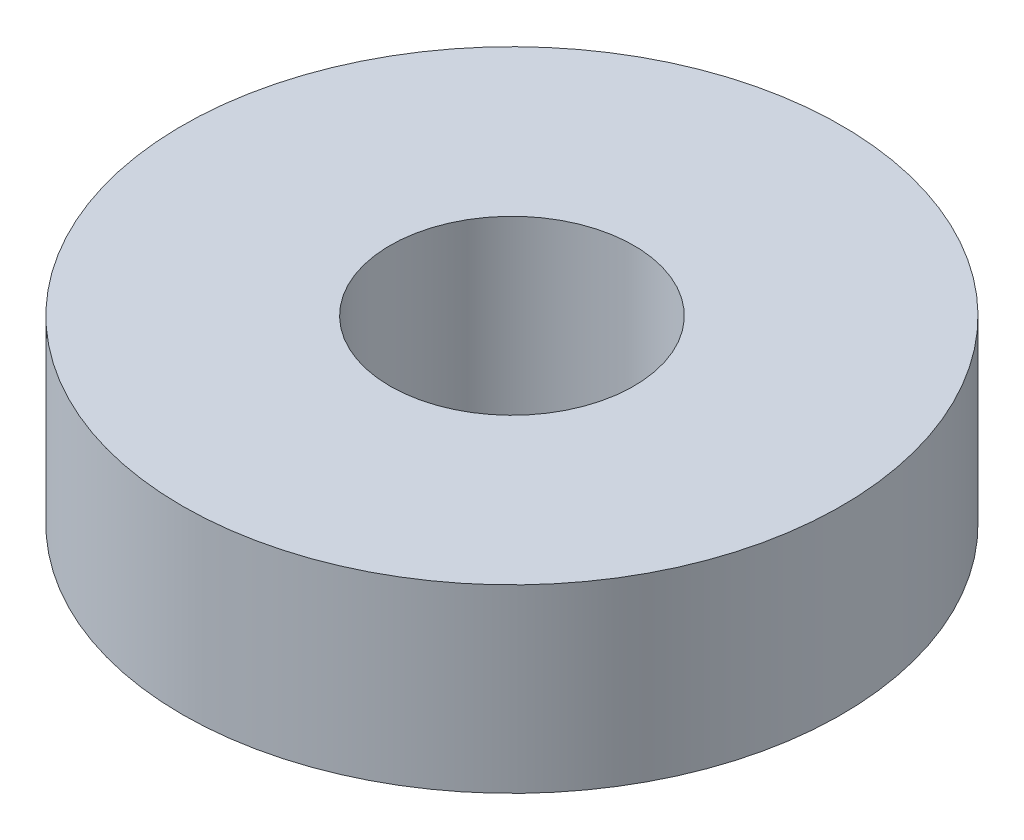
SolidWorks part; units mm, degrees
ref_plane "Front Plane" through (0, 0, 0) normal (0, 0, 1) x (1, 0, 0)
ref_plane "Top Plane" through (0, 0, 0) normal (0, 1, 0) x (1, 0, 0)
ref_plane "Right Plane" through (0, 0, 0) normal (1, 0, 0) x (0, 0, -1)
sketch "Sketch1" plane through (0, 0, 0) normal (0, 1, 0) x (1, 0, 0)
  circle A0 centre (0, 0) radius 3.429
  circle A1 centre (0, 0) radius 9.271
  dimension "D1" = 6.858
  dimension "D2" = 18.542
extrude "Boss-Extrude1" add sketch "Sketch1" along normal blind 5.08
